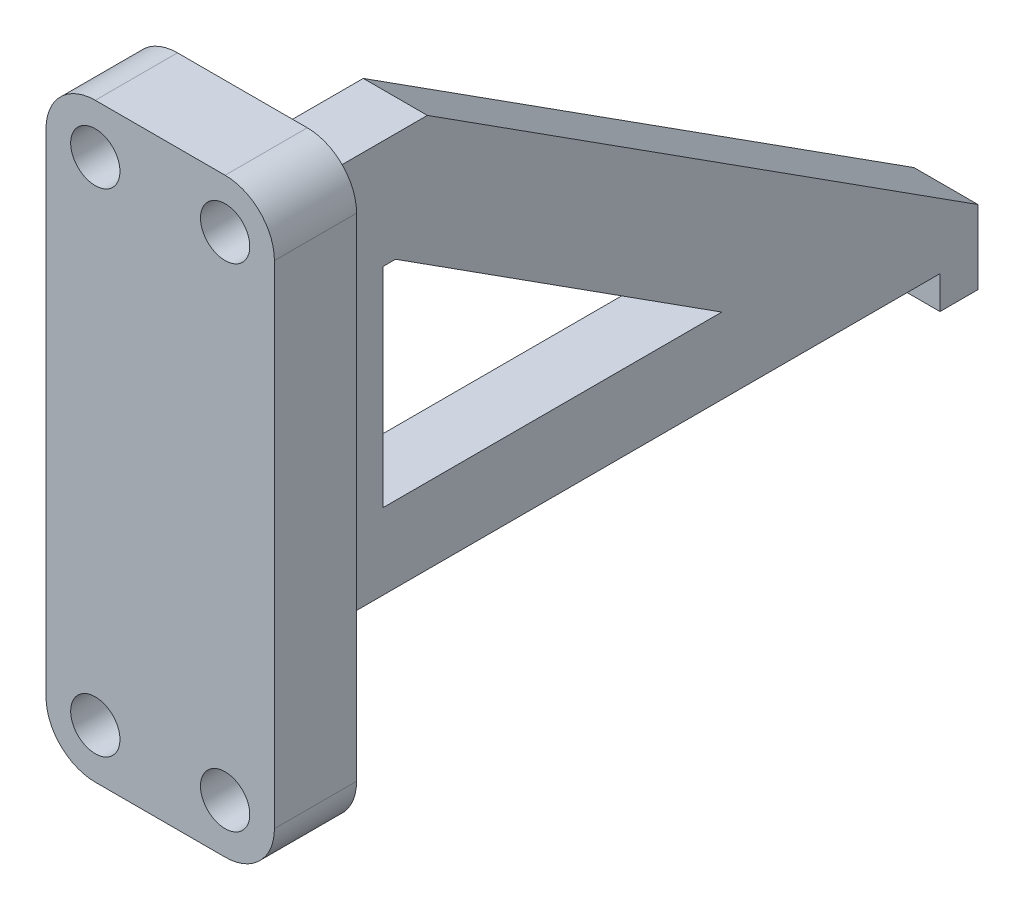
SolidWorks part; units mm, degrees
ref_plane "Alzado" through (0, 0, 0) normal (0, 0, 1) x (1, 0, 0)
ref_plane "Planta" through (0, 0, 0) normal (0, 1, 0) x (1, 0, 0)
ref_plane "Vista lateral" through (0, 0, 0) normal (1, 0, 0) x (0, 0, -1)
sketch "Croquis1" plane through (0, 0, 0) normal (1, 0, 0) x (0, 0, -1)
  line L0 (0, 51.8721) -> (0, 0)
  line L1 (0, 51.8721) -> (18.6118, 51.8721)
  line L2 (18.6118, 51.8721) -> (85.6249, 8.9725)
  line L3 (85.6249, 8.9725) -> (85.6249, 0)
  line L4 (85.6249, 0) -> (0, 0)
extrude "Extruir1" add sketch "Croquis1" along normal blind 7.7979
sketch "Croquis2" plane through (0, 0, 0) normal (0, 0, 1) x (1, 0, 0)
  line L8 (-10, 61.8721) -> (-10, -10)
  line L9 (-10, -10) -> (17.7979, -10)
  line L10 (17.7979, -10) -> (17.7979, 61.8721)
  line L11 (17.7979, 61.8721) -> (-10, 61.8721)
  line L12 (-10, 61.8721) -> (-10, -10)
  line L13 (-10, -10) -> (17.7979, -10)
  line L14 (17.7979, -10) -> (17.7979, 61.8721)
  line L15 (17.7979, 61.8721) -> (-10, 61.8721)
  dimension "D1" = 10
extrude "Extruir2" add sketch "Croquis2" along normal blind 10
sketch "Croquis3" plane through (0, 0, 0) normal (0, 0, -1) x (-1, 0, 0)
  line L0 (-17.7979, 61.8721) -> (10, 61.8721) construction
  line L1 (-17.7979, -10) -> (-17.7979, 61.8721) construction
  line L2 (10, 61.8721) -> (10, -10) construction
  line L3 (10, -10) -> (-17.7979, -10) construction
  circle A0 centre (-11.7979, 55.8721) radius 3
  circle A1 centre (4, 55.8721) radius 3
  circle A2 centre (-11.7979, -4) radius 3
  circle A3 centre (4, -4) radius 3
  dimension "D1" = 6
  dimension "D2" = 6
  dimension "D3" = 6
  dimension "D4" = 6
  dimension "D5" = 6
  dimension "D6" = 6
  dimension "D7" = 6
  dimension "D8" = 6
  dimension "D9" = 6
  dimension "D10" = 6
  dimension "D11" = 6
  dimension "D12" = 6
extrude "Extruir3" cut sketch "Croquis3" against normal blind 10
fillet "Redondeo3" radius 6 4 edges at (17.7979, 61.8721, 5) (-10, 61.8721, 5) (17.7979, -10, 5) (-10, -10, 5)
sketch "Croquis5" plane through (0, 0, 0) normal (-1, 0, 0) x (0, 0, 1)
  line L11 (-14.7404, 38.644) -> (-54.4424, 13.2281)
  line L12 (-54.4424, 13.2281) -> (-13.2281, 13.2281)
  line L13 (-13.2281, 13.2281) -> (-13.2281, 38.644)
  line L15 (-14.7404, 38.644) -> (-54.4424, 13.2281)
  line L16 (-54.4424, 13.2281) -> (-13.2281, 13.2281)
  line L17 (-13.2281, 13.2281) -> (-13.2281, 38.644)
  line L66 (-13.2281, 38.644) -> (-14.7404, 38.644)
  line L67 (-13.2281, 38.644) -> (-14.7404, 38.644)
  dimension "D1" = 13.2281
extrude "Extruir4" cut sketch "Croquis5" against normal blind 10
sketch "Croquis6" plane through (0, 0, 0) normal (-1, 0, 0) x (0, 0, 1)
  line L0 (0, 55.8721) -> (0, -4) construction
  line L1 (-81, 4) -> (-4, 4)
  line L2 (-81, 4) -> (-81, -13.2867)
  line L3 (-81, -13.2867) -> (-4, -13.2867)
  line L4 (-4, 4) -> (-4, -13.2867)
  line L7 (0, 0) -> (-85.6249, 0) construction
  dimension "D1" = 4
  dimension "D2" = 77
  dimension "D3" = 4
extrude "Extruir5" cut sketch "Croquis6" against normal blind 10
